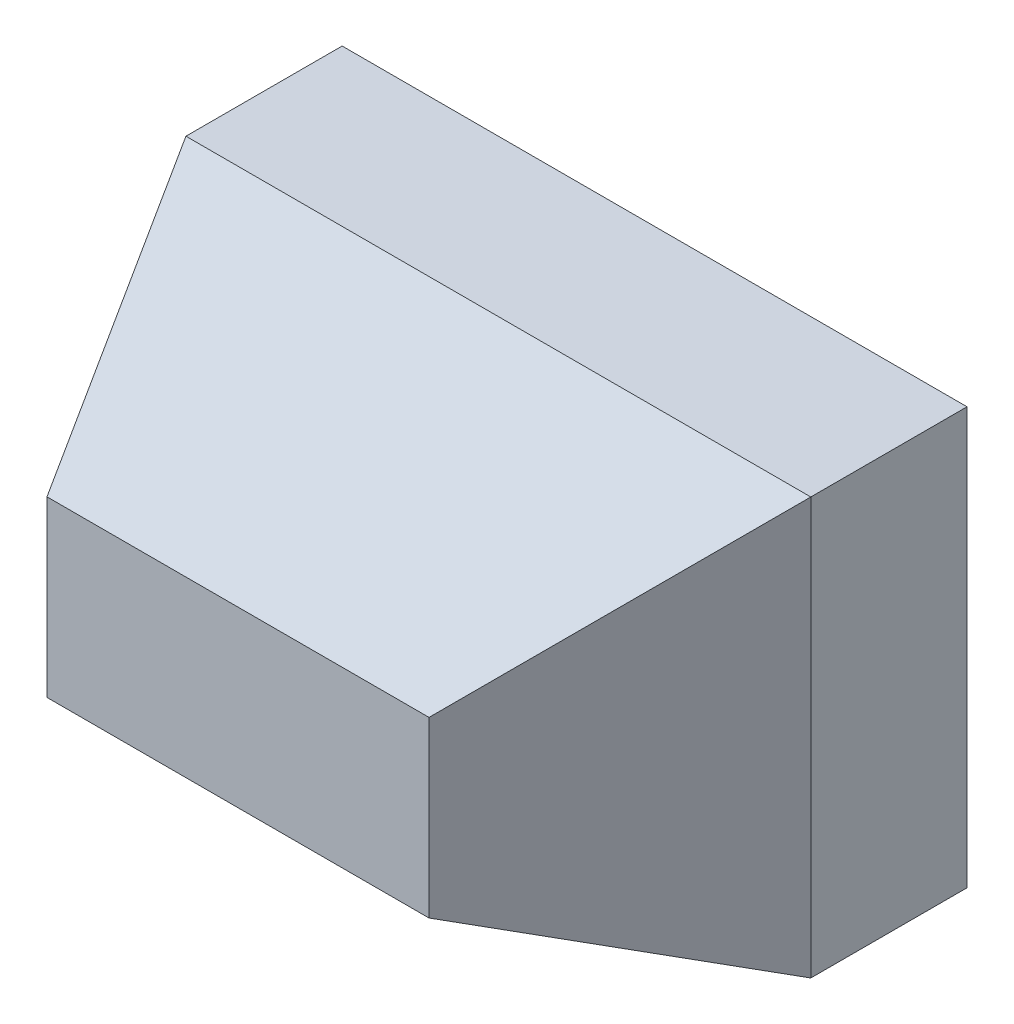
SolidWorks part; units mm, degrees
ref_plane "前视基准面" through (0, 0, 0) normal (0, 0, 1) x (1, 0, 0)
ref_plane "上视基准面" through (0, 0, 0) normal (0, 1, 0) x (1, 0, 0)
ref_plane "右视基准面" through (0, 0, 0) normal (1, 0, 0) x (0, 0, -1)
sketch "草图1" plane through (0, 0, 0) normal (0, 0, 1) x (1, 0, 0)
  line L0 (-100.3592, 0) -> (98.7534, 0) construction
  line L1 (0, -59.8141) -> (0, 60.2155) construction
  line L3 (-60, 40) -> (60, 40)
  line L4 (-60, 40) -> (-60, -40)
  line L5 (-60, -40) -> (60, -40)
  line L6 (60, 40) -> (60, -40)
  dimension "D1" = 120
  dimension "D2" = 80
extrude "拉伸1" add sketch "草图1" along normal blind 50 draft 25
sketch "草图2" plane through (0, 0, 0) normal (0, 0, -1) x (-1, 0, 0)
  line L4 (60, -40) -> (60, 40)
  line L5 (60, 40) -> (-60, 40)
  line L6 (-60, 40) -> (-60, -40)
  line L7 (-60, -40) -> (60, -40)
  line L8 (60, -40) -> (60, 40)
  line L9 (60, 40) -> (-60, 40)
  line L10 (-60, 40) -> (-60, -40)
  line L11 (-60, -40) -> (60, -40)
  dimension "D1" = 0
extrude "拉伸2" add sketch "草图2" along normal blind 30
